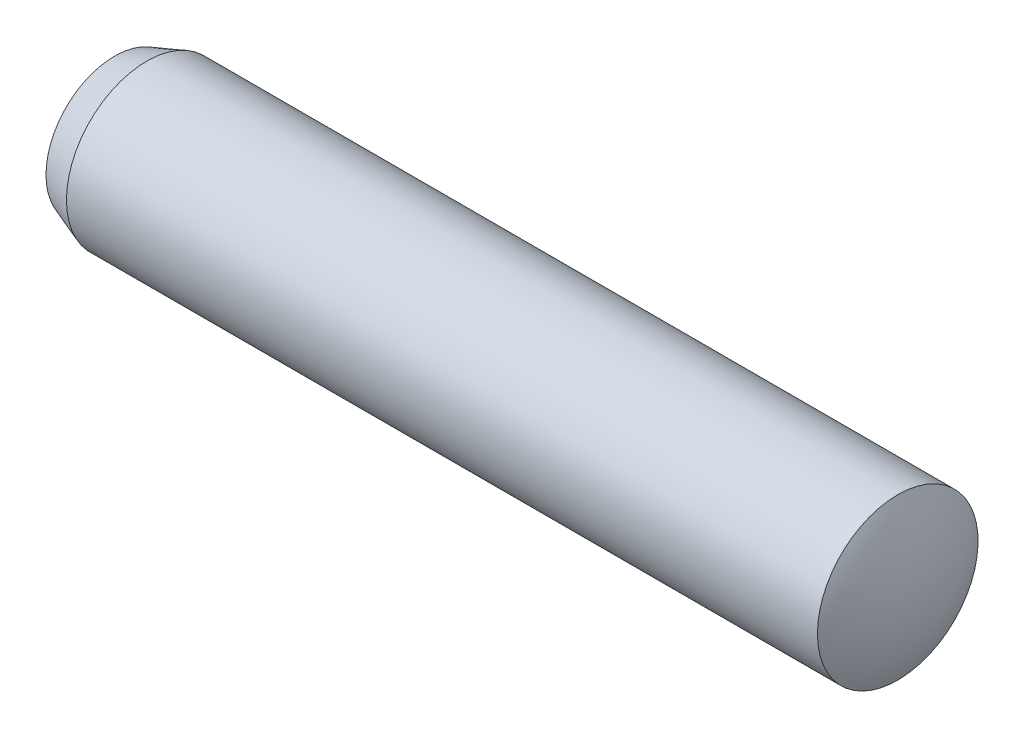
SolidWorks part; units mm, degrees
ref_plane "Plan1" through (0, 0, 0) normal (0, 0, 1) x (1, 0, 0)
ref_plane "Plan2" through (0, 0, 0) normal (0, 1, 0) x (1, 0, 0)
ref_plane "Plan3" through (0, 0, 0) normal (1, 0, 0) x (0, 0, -1)
sketch "Esquisse1" plane through (0, 0, 0) normal (0, 0, 1) x (1, 0, 0)
  line L0 (0, 0) -> (0, 3.4176)
  line L1 (0, 3.4176) -> (1.6, 4)
  line L2 (1.6, 4) -> (39, 4)
  line L3 (0, 0) -> (40, 0) construction
  line L4 (0, 0) -> (40, 0)
  arc A0 (39, 4) -> (40, 0) centre (31.5, 0) cw
  dimension "D1" = 40
  dimension "D2" = 4
  dimension "D3" = 1
  dimension "D4" = 1.6
  dimension "D5" = 20
revolve "Base-Révolution" add sketch "Esquisse1" angle 360 about L3
